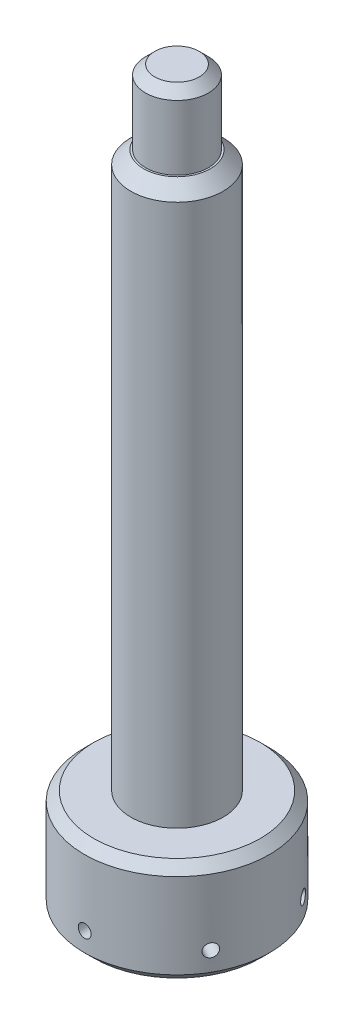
SolidWorks part; units mm, degrees
ref_plane "Front Plane" through (0, 0, 0) normal (0, 0, 1) x (1, 0, 0)
ref_plane "Top Plane" through (0, 0, 0) normal (0, 1, 0) x (1, 0, 0)
ref_plane "Right Plane" through (0, 0, 0) normal (1, 0, 0) x (0, 0, -1)
sketch "Sketch1" plane through (0, 0, 0) normal (0, 1, 0) x (1, 0, 0)
  circle A0 centre (0, 0) radius 6.35
  dimension "D1" = 12.7
extrude "Extrude1" add sketch "Sketch1" along normal blind 4.572
sketch "Sketch4" plane through (0, 0, 0) normal (0, -1, 0) x (1, 0, 0)
  circle A1 centre (0, 0) radius 6.35
  circle A2 centre (0, 0) radius 6.35
  dimension "D1" = 0
extrude "Extrude4" add sketch "Sketch4" along normal blind 1.27
sketch "Sketch5" plane through (0, 4.572, 0) normal (0, 1, 0) x (1, 0, 0)
  circle A1 centre (0, 0) radius 6.35
  circle A2 centre (0, 0) radius 6.35
  dimension "D1" = 0
extrude "Extrude5" add sketch "Sketch5" along normal blind 1.27
sketch "Sketch2" plane through (0, 5.842, 0) normal (0, 1, 0) x (1, 0, 0)
  circle A0 centre (0, 0) radius 3.175
  dimension "D1" = 6.35
extrude "Extrude2" add sketch "Sketch2" along normal blind 38.1
sketch "Sketch3" plane through (0, 43.942, 0) normal (0, 1, 0) x (1, 0, 0)
  circle A0 centre (0, 0) radius 2.159
  dimension "D1" = 4.318
extrude "Extrude3" add sketch "Sketch3" along normal blind 5.08
chamfer "Chamfer1" distance 0.635 angle 45 2 edges at (0, -1.27, -6.35) (0, 5.842, 6.35)
chamfer "Chamfer2" distance 0.889 angle 45 1 edges at (0, 43.942, 3.175)
chamfer "Chamfer3" distance 0.635 angle 45 1 edges at (0, 49.022, 2.159)
ref_point "Point1"
sketch "Sketch6" plane through (0, 0, 0) normal (0, 0, 1) x (1, 0, 0)
  line L0 (0, -0.635) -> (-0.635, -1.27)
  line L1 (-6.35, -0.635) -> (6.35, -0.635) construction
  line L2 (-5.715, -1.27) -> (5.715, -1.27) construction
  line L3 (0, -0.635) -> (0.635, -1.27)
  line L4 (-0.635, -1.27) -> (0.635, -1.27)
extrude "Extrude7" cut sketch "Sketch6" against normal through all and the other way through all
sketch "Sketch7" plane through (0, 0, 0) normal (0, 0, 1) x (1, 0, 0)
  circle A0 centre (0, 0.6799) radius 0.4445
  dimension "D1" = 0.889
extrude "Extrude8" cut sketch "Sketch7" against normal through all and the other way through all
pattern_circular "CirPattern1" count 3 over 360 about axis through (0, 43.942, 0) along (0, -1, 0) of "Extrude8"
